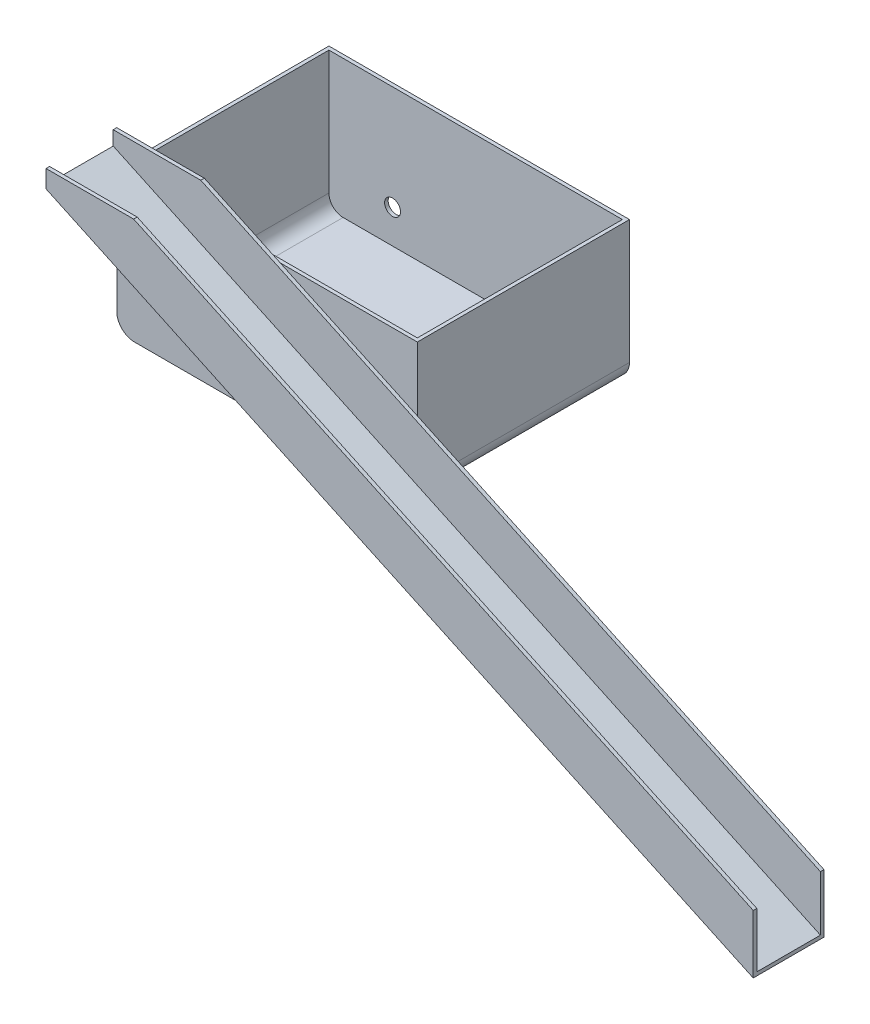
SolidWorks part; units mm, degrees
ref_plane "前视基准面" through (0, 0, 0) normal (0, 0, 1) x (1, 0, 0)
ref_plane "上视基准面" through (0, 0, 0) normal (0, 1, 0) x (1, 0, 0)
ref_plane "右视基准面" through (0, 0, 0) normal (1, 0, 0) x (0, 0, -1)
sketch "草图1" plane through (0, 0, 0) normal (0, 0, 1) x (1, 0, 0)
  line L0 (85, 88.2615) -> (85, 70.176)
  line L1 (0, 88.2615) -> (0, 53.2615)
  line L2 (80, 48.2615) -> (5, 48.2615)
  line L3 (0, 88.2615) -> (85, 88.2615)
  line L4 (0, 53.2615) -> (0, 48.2615)
  line L5 (0, 48.2615) -> (5, 48.2615)
  line L6 (85, 70.176) -> (85, 53.6254)
  line L7 (85, 53.6254) -> (85, 48.2615)
  line L8 (85, 48.2615) -> (80, 48.2615)
extrude "凸台-拉伸1" add sketch "草图1" along normal blind 60
fillet "圆角1" radius 5 2 edges at (85, 48.2615, 30) (0, 48.2615, 30)
shell "抽壳1" thickness 1
sketch "草图2" plane through (0, 0, 60) normal (0, 0, 1) x (1, 0, 0)
  line L0 (0, 93.2615) -> (200, 0)
  line L1 (0, 93.2615) -> (0, 98.2615)
  line L2 (200, 0) -> (200, 16.5507)
  line L3 (0, 98.2615) -> (24.7705, 98.2615)
  line L4 (24.7705, 98.2615) -> (200, 16.5507)
extrude "凸台-拉伸2" add sketch "草图2" along normal blind 20
sketch "草图3" plane through (200, 0, 0) normal (1, 0, 0) x (0, 0, -1)
  line L0 (-80, 0) -> (-80, 16.5507) construction
  line L1 (-79, 25.1033) -> (-61, 25.1033)
  line L2 (-79, 25.1033) -> (-79, 1)
  line L3 (-79, 1) -> (-61, 1)
  line L4 (-61, 25.1033) -> (-61, 1)
  line L5 (-80, 0) -> (-60, 0) construction
  line L6 (-60, 0) -> (-60, 16.5507) construction
  point P4 (-80, 8.2753)
  dimension "D1" = 1
  dimension "D2" = 1
  dimension "D3" = 1
sketch "草图4" plane through (0, 0, 80) normal (0, 0, 1) x (1, 0, 0)
  line L0 (200, 0) -> (0, 93.2615)
sweep "切除-扫描1" cut profiles "草图3" path "草图4"
sketch "草图5" plane through (0, 0, 1) normal (0, 0, 1) x (1, 0, 0)
  circle A0 centre (19, 58.7615) radius 2.25
  circle A1 centre (66, 58.7615) radius 2.25
extrude "切除-拉伸1" cut sketch "草图5" against normal blind 20
